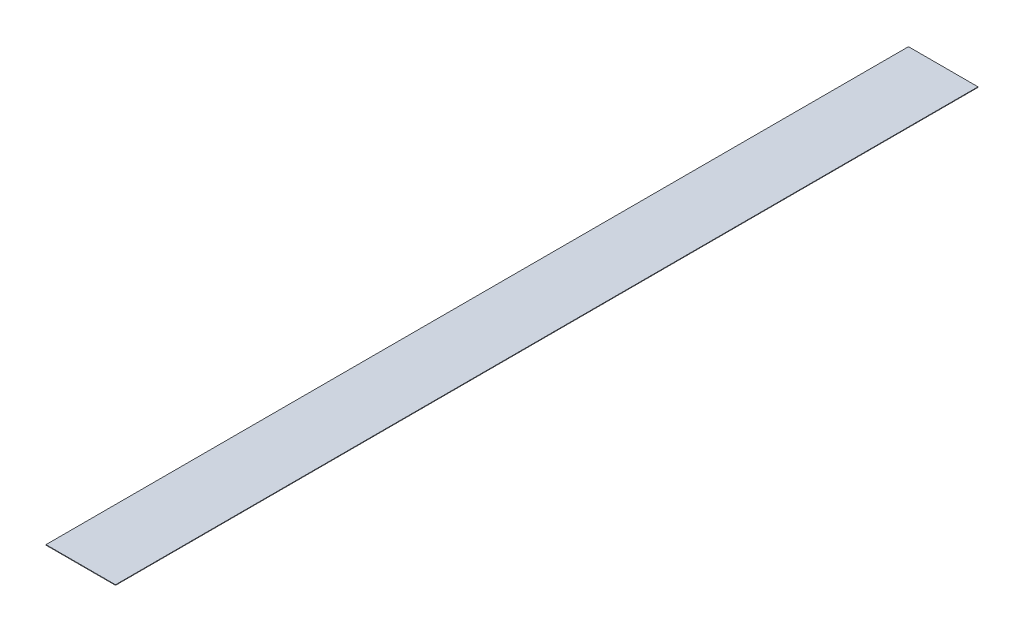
SolidWorks part; units mm, degrees
ref_plane "Front" through (0, 0, 0) normal (0, 0, 1) x (1, 0, 0)
ref_plane "Top" through (0, 0, 0) normal (0, 1, 0) x (1, 0, 0)
ref_plane "Right" through (0, 0, 0) normal (1, 0, 0) x (0, 0, -1)
sketch "Sketch1" plane through (0, 0, 0) normal (0, 1, 0) x (1, 0, 0)
  line L0 (12.0527, 149.5) -> (-12.0527, -149.5) construction
  line L1 (-12.0527, 149.5) -> (12.0527, 149.5)
  line L2 (-12.0527, 149.5) -> (-12.0527, -149.5)
  line L3 (-12.0527, -149.5) -> (12.0527, -149.5)
  line L4 (12.0527, 149.5) -> (12.0527, -149.5)
  point P4 (0, 0)
  dimension "D1" = 299
  dimension "D2" = 24.1054
extrude "Extrude1" add sketch "Sketch1" along normal blind 0.175
